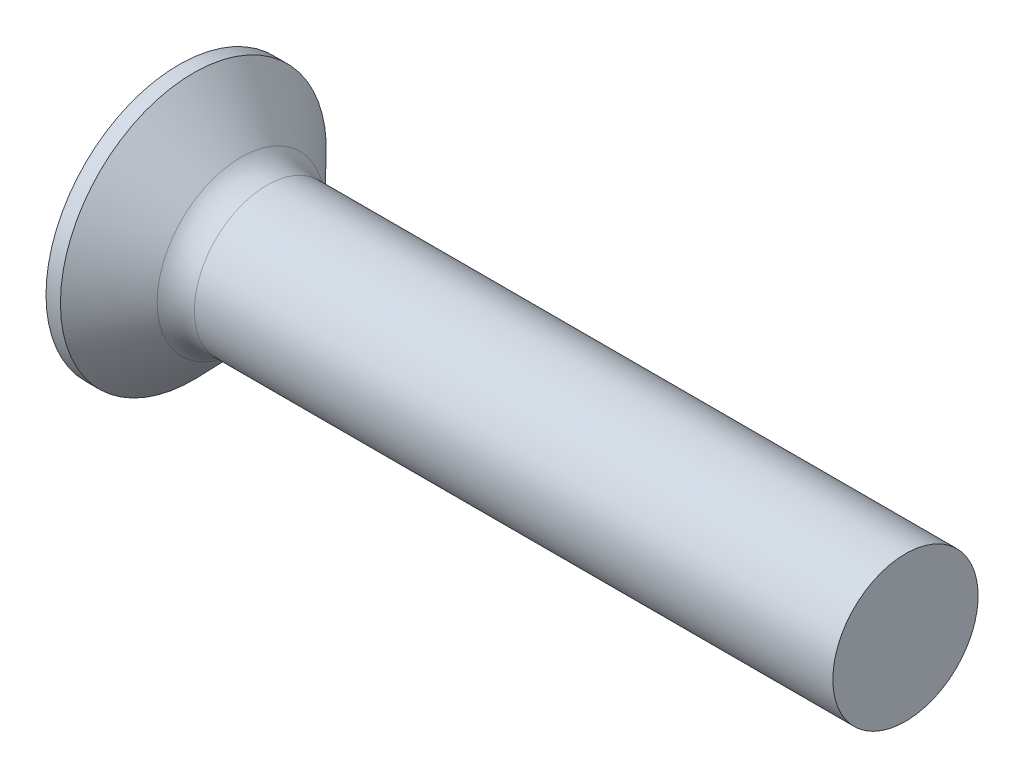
SolidWorks part; units mm, degrees
ref_plane "Plane1" through (0, 0, 0) normal (0, 0, 1) x (1, 0, 0)
ref_plane "Plane2" through (0, 0, 0) normal (0, 1, 0) x (1, 0, 0)
ref_plane "Plane3" through (0, 0, 0) normal (1, 0, 0) x (0, 0, -1)
revolve "Base-Revolve" add sketch "BodySke"
sketch "BodySke" plane through (0, 0, 0) normal (0, 0, 1) x (1, 0, 0)
  line L0 (0, 0) -> (0, 9.15)
  line L1 (0, 9.15) -> (0.9924, 9.15)
  line L2 (5, 5) -> (50, 5)
  line L3 (50, 5) -> (50, 0)
  line L4 (50, 0) -> (0, 0)
  line L5 (-6.35, 0) -> (82.55, 0) construction
  line L6 (5, -5) -> (50, -5) construction
  line L7 (0.9924, -9.15) -> (5, -5) construction
  line L8 (0.9924, 9.15) -> (5, 5)
  line L9 (0, -9.15) -> (0.9924, -9.15) construction
  line L10 (6.5, 6.5875) -> (6.5, -2.9375) construction
  line L11 (0, 6.35) -> (0, -3.175) construction
  dimension "Diameter" = 10
  dimension "Length" = 50
  dimension "Head_ht" = 5
  dimension "Head_dia" = 18.3
  dimension "Head_ang" = 92
  dimension "D6" = 0.9924
  dimension "Advance" = 1.5
  dimension "Thread_nom" = 50
fillet "Fillet1" radius 2.5 1 edges at (5, 0, 5)
sketch "Sketch3" plane through (0, 0, 0) normal (-1, 0, 0) x (0, 0, 1)
  line L0 (-1.08, 4.9) -> (1.08, 4.9)
  line L1 (1.08, 4.9) -> (1.08, -4.9)
  line L2 (1.08, -4.9) -> (-1.08, -4.9)
  line L3 (-1.08, -4.9) -> (-1.08, 4.9)
  dimension "D1" = 4.9
  dimension "Cross_dia" = 9.8
  dimension "D2" = 1.08
  dimension "Cross_width" = 2.16
ref_plane "Plane4" through (5.64, 0, 0) normal (-1, 0, 0) x (0, 0, 1)
sketch "Sketch4" plane through (5.64, 0, 0) normal (-1, 0, 0) x (0, 0, 1)
  line L0 (-1.08, 2.088) -> (1.08, 2.088)
  line L3 (1.08, 2.088) -> (1.08, -2.088)
  line L4 (1.08, -2.088) -> (-1.08, -2.088)
  line L5 (-1.08, -2.088) -> (-1.08, 2.088)
  dimension "D1" = 2.16
  dimension "D2" = 4.176
  dimension "D3" = 1.08
  dimension "D4" = 2.088
loft "Recess" cut profiles "Sketch3", "Sketch4"
pattern_circular "RecPat" count 2 every 90 about axis through (0, 0, 0) along (1, 0, 0) of "Recess"
sketch "RecCorSke" plane through (0, 0, 0) normal (0, 0, 1) x (1, 0, 0)
  line L0 (-3.175, 0) -> (15.875, 0) construction
  line L2 (0, 0) -> (0, 2.3249)
  line L3 (0, 2.3249) -> (5.64, 1.9305)
  line L4 (5.64, 1.9305) -> (6.2673, 0)
  line L5 (6.2673, 0) -> (0, 0)
  dimension "Diameter" = 3.861
  dimension "Depth" = 5.64
  dimension "Draft_angle" = 4
  dimension "Bottom_angle" = 18
revolve "RecessCore" cut sketch "RecCorSke" angle 360 about L0
sketch "ThdSchSke" plane through (0, 0, 0) normal (0, 0, 1) x (1, 0, 0)
  line L0 (6.5, -3.9624) -> (5.7735, -5)
  line L1 (6.5, -3.9624) -> (7.2265, -5)
  line L2 (7.2265, -5) -> (7.2265, -6.25)
  line L3 (-3.175, 0) -> (5.1513, 0) construction
  line L5 (7.2265, -6.25) -> (5.7735, -6.25)
  line L6 (5.7735, -6.25) -> (5.7735, -5)
  line L7 (0, 9.15) -> (0, -9.15) construction
  dimension "Thread_minor" = 7.9248
  dimension "Diameter" = 10
  dimension "Start" = 6.5
  dimension "SideAngle" = 55
  dimension "VeeAngle" = 70
  dimension "Overcut" = 12.5
revolve "ThreadSchematic" cut sketch "ThdSchSke" angle 360 about L3
pattern_linear "ThdSchPat"
equation "\"D1@Sketch3\" = \"Cross_dia@Sketch3\" / 2"
equation "\"D2@Sketch3\" = \"Cross_width@Sketch3\" / 2"
equation "\"Depth@RecCorSke\" = \"Cross_depth@Plane4\""
equation "\"D1@Sketch4\" = \"Cross_width@Sketch3\""
equation "\"D2@Sketch4\" = \"Cross_dia@Sketch3\" - 2.0 * \"Cross_depth@Plane4\" * tan(26.5  * 0.017453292)"
equation "\"D3@Sketch4\" = \"D1@Sketch4\" / 2"
equation "\"D4@Sketch4\" = \"D2@Sketch4\" / 2"
equation "\"Thread_length@ThreadCosmetic\" = ((sgn( (\"Length@BodySke\" - \"Advance@BodySke\" * 1.0 - \"Head_ht@BodySke\" ) - \"Thread_nom@BodySke\" )-1)*( (\"Length@BodySke\" - \"Advance@BodySke\" * 1.0 - \"Head_ht@BodySke\" "
equation "\"Thread_minor@ThdSchSke\" = \"Thread_minor@ThreadCosmetic\""
equation "\"Diameter@ThdSchSke\" = \"Diameter@BodySke\""
equation "\"Overcut@ThdSchSke\" = \"Diameter@BodySke\" * 1.25"
equation "\"Start@ThdSchSke\" = 0.000001 + \"Length@BodySke\" - \"Thread_length@ThreadCosmetic\"  '---Countersunk---"
equation "\"Num_threads@ThdSchPat\" = int( \"Thread_length@ThreadCosmetic\" / \"Advance@BodySke\" + 0.999 )  + 1"
equation "\"Advance@ThdSchPat\" = \"Thread_length@ThreadCosmetic\" /  (\"Num_threads@ThdSchPat\" - 1) 'relax it"
